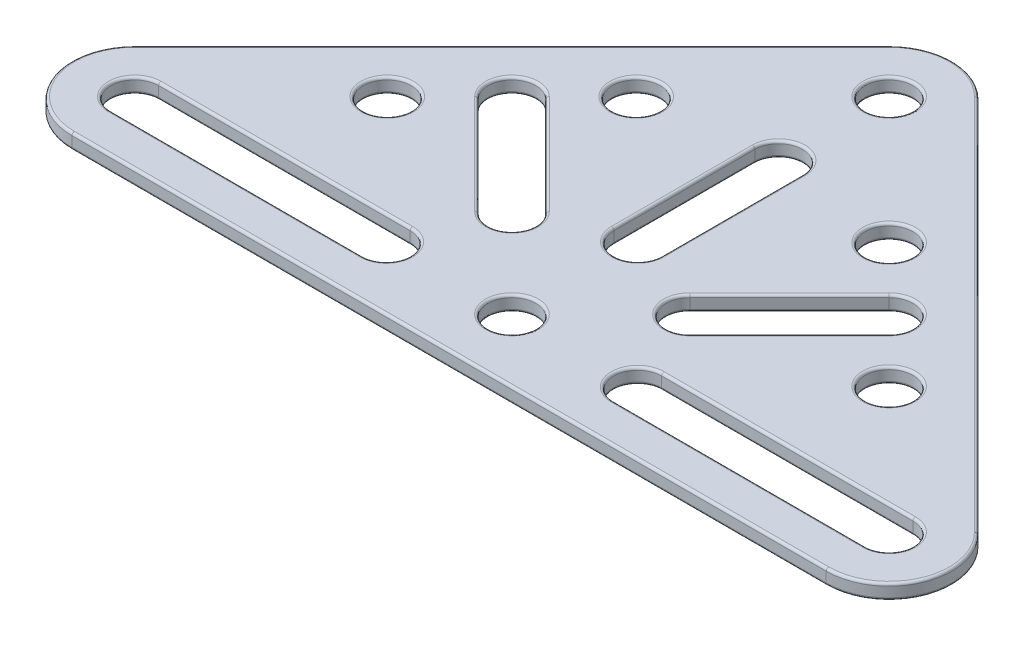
SolidWorks part; units mm, degrees
ref_plane "Front" through (0, 0, 0) normal (0, 0, 1) x (1, 0, 0)
ref_plane "Top" through (0, 0, 0) normal (0, 1, 0) x (1, 0, 0)
ref_plane "Right" through (0, 0, 0) normal (1, 0, 0) x (0, 0, -1)
sketch "Sketch1" plane through (0, 0, 0) normal (0, 1, 0) x (1, 0, 0)
  line L0 (15.3303, 0) -> (91.5303, 0)
  line L1 (96.0204, 10.8401) -> (57.9204, 48.9401)
  line L2 (48.9401, 48.9401) -> (10.8401, 10.8401)
  arc A0 (57.9204, 48.9401) -> (48.9401, 48.9401) centre (53.4303, 44.45) ccw
  arc A1 (15.3303, 0) -> (10.8401, 10.8401) centre (15.3303, 6.35) cw
  arc A2 (91.5303, 0) -> (96.0204, 10.8401) centre (91.5303, 6.35) ccw
  circle A3 centre (53.4303, 44.45) radius 2.413
  circle A4 centre (53.4303, 6.35) radius 2.413
  point P9 (0, 0)
  dimension "D2" = 6.35
  dimension "D4" = 4.826
  dimension "D1" = 45
  dimension "D3" = 76.2
extrude "Extrude1" add sketch "Sketch1" along normal blind 1.524
sketch "Sketch2" plane through (0, 1.524, 0) normal (0, 1, 0) x (-1, 0, 0)
  line L0 (-48.9401, -48.9401) -> (-10.8401, -10.8401) construction
  line L2 (-74.1865, -23.6938) -> (-64.1286, -13.6359)
  line L4 (-70.774, -27.1062) -> (-60.7161, -17.0484)
  line L5 (-96.0204, -10.8401) -> (-57.9204, -48.9401) construction
  circle A1 centre (-53.4303, -6.35) radius 2.413 construction
  arc A3 (-60.7161, -17.0484) -> (-64.1286, -13.6359) centre (-62.4224, -15.3421) ccw
  arc A4 (-74.1865, -23.6938) -> (-70.774, -27.1062) centre (-72.4803, -25.4) ccw
  dimension "D3" = 6.35
  dimension "D4" = 2.413
  dimension "D1" = 4.826
  dimension "D2" = 14.224
extrude "Cut-Extrude1" cut sketch "Sketch2" against normal through all
pattern_circular "CirPattern1" count 3 over 90 about axis through (53.4303, 0, -6.35) along (0, 1, 0) of "Cut-Extrude1"
sketch "Sketch3" plane through (0, 1.524, 0) normal (0, 1, 0) x (-1, 0, 0)
  line L0 (-48.9401, -48.9401) -> (-10.8401, -10.8401) construction
  line L1 (-15.3303, -8.763) -> (-40.7303, -8.763)
  line L3 (-15.3303, -3.937) -> (-40.7303, -3.937)
  arc A0 (-15.3303, -8.763) -> (-15.3303, -3.937) centre (-15.3303, -6.35) ccw
  arc A1 (-10.8401, -10.8401) -> (-15.3303, 0) centre (-15.3303, -6.35) ccw construction
  arc A2 (-40.7303, -3.937) -> (-40.7303, -8.763) centre (-40.7303, -6.35) ccw
  circle A3 centre (-53.4303, -6.35) radius 2.413 construction
  circle A4 centre (-28.0822, -19.102) radius 2.413
  circle A5 centre (-40.6546, -31.6743) radius 2.413
  circle A6 centre (-53.4303, -44.45) radius 2.413 construction
  dimension "D1" = 4.826
  dimension "D2" = 12.7
  dimension "D6" = 6.35
  dimension "D3" = 18.034
  dimension "D4" = 35.814
  dimension "D5" = 6.35
extrude "Cut-Extrude2" cut sketch "Sketch3" against normal through all
ref_plane "Plane1" through (53.4303, 0, 0) normal (-1, 0, 0) x (0, 0, 1)
mirror "Mirror1" about plane through (53.4303, 0, 0) normal (-1, 0, 0) of "Cut-Extrude2"
fillet "Fillet1" radius 0.254 64 edges at (66.2059, 0, -29.2613) (78.8303, 0, -3.937) (63.7173, 0, -6.35) (78.8303, 0, -8.763) (93.9433, 0, -6.35) (40.6546, 0, -29.2613) (28.0822, 0, -16.689) (43.1433, 0, -6.35) (28.0303, 0, -3.937) (12.9173, 0, -6.35) (28.0303, 0, -8.763) (46.1444, 0, -13.6359) (37.703, 0, -18.6648) (32.674, 0, -27.1062) (41.1154, 0, -22.0773) (53.4303, 0, -16.6538) (51.0173, 0, -26.1788) (53.4303, 0, -35.7038) (55.8433, 0, -26.1788) (60.7161, 0, -13.6359) (65.7451, 0, -22.0773) (74.1865, 0, -27.1062) (69.1576, 0, -18.6648) (53.4303, 0, -42.037) (29.8901, 0, -29.8901) (9.4636, 0, -3.92) (53.4303, 0, 0) (97.3969, 0, -3.92) (76.9704, 0, -29.8901) (53.4303, 0, -50.8) (53.4303, 0, -3.937) (78.7783, 0, -16.689) (66.2059, 1.524, -29.2613) (63.7173, 1.524, -6.35) (78.8303, 1.524, -3.937) (93.9433, 1.524, -6.35) (78.8303, 1.524, -8.763) (40.6546, 1.524, -29.2613) (28.0822, 1.524, -16.689) (28.0303, 1.524, -3.937) (43.1433, 1.524, -6.35) (28.0303, 1.524, -8.763) (12.9173, 1.524, -6.35) (37.703, 1.524, -18.6648) (46.1444, 1.524, -13.6359) (41.1154, 1.524, -22.0773) (32.674, 1.524, -27.1062) (51.0173, 1.524, -26.1788) (53.4303, 1.524, -16.6538) (55.8433, 1.524, -26.1788) (53.4303, 1.524, -35.7038) (65.7451, 1.524, -22.0773) (60.7161, 1.524, -13.6359) (69.1576, 1.524, -18.6648) (74.1865, 1.524, -27.1062) (53.4303, 1.524, -42.037) (76.9704, 1.524, -29.8901) (97.3969, 1.524, -3.92) (53.4303, 1.524, 0) (9.4636, 1.524, -3.92) (29.8901, 1.524, -29.8901) (53.4303, 1.524, -50.8) (53.4303, 1.524, -3.937) (78.7783, 1.524, -16.689)
